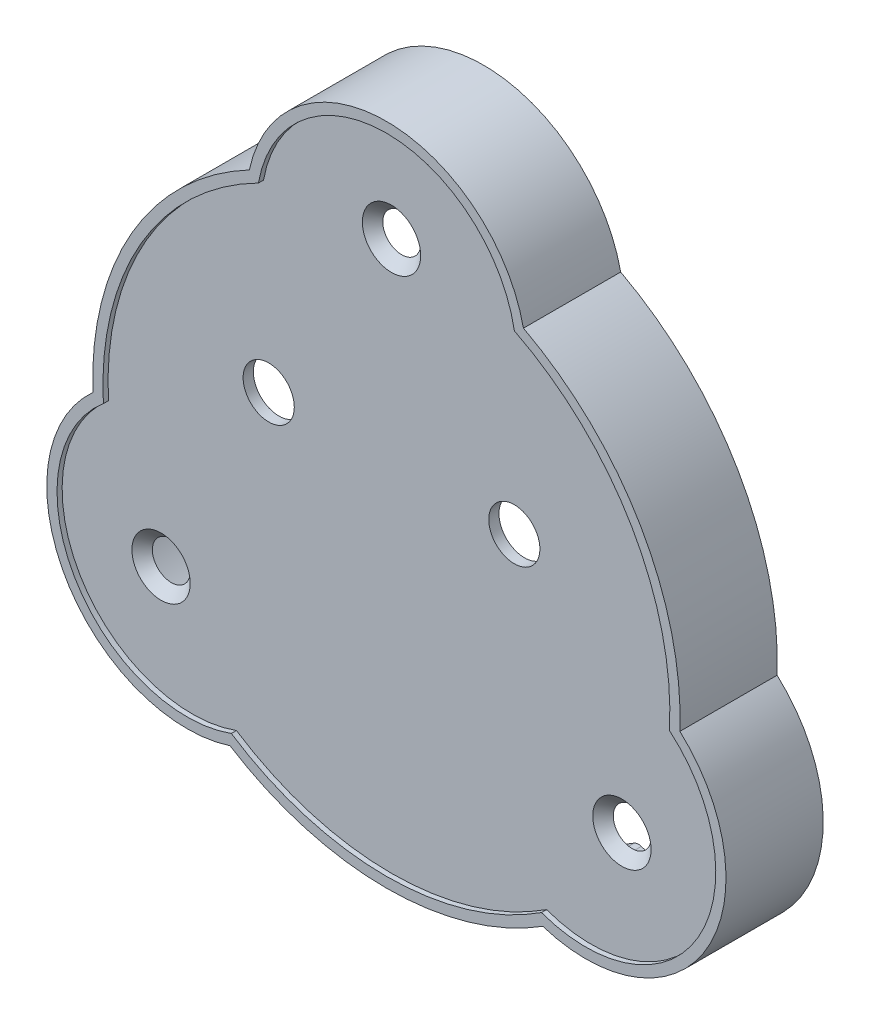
SolidWorks part; units mm, degrees
ref_plane "Спереди" through (0, 0, 0) normal (0, 0, 1) x (1, 0, 0)
ref_plane "Сверху" through (0, 0, 0) normal (0, 1, 0) x (1, 0, 0)
ref_plane "Справа" through (0, 0, 0) normal (1, 0, 0) x (0, 0, -1)
sketch "Эскиз1" plane through (0, 0, -4.0645) normal (0, 0, 1) x (1, 0, 0)
  arc A115 (5.7573, -12.2485) -> (6.0461, -11.585) centre (5.2474, -11.6321) ccw
  arc A116 (5.7573, -12.2485) -> (17.2937, -32.2301) centre (13.2142, -21.2643) ccw
  arc A117 (18.0127, -32.3118) -> (17.2937, -32.2301) centre (17.5726, -32.9799) ccw
  arc A118 (18.0127, -32.3118) -> (47.387, -32.3118) centre (32.6998, -10.0143) ccw
  arc A119 (48.106, -32.2301) -> (47.387, -32.3118) centre (47.827, -32.9799) ccw
  arc A120 (48.106, -32.2301) -> (59.6423, -12.2485) centre (52.1854, -21.2643) ccw
  arc A121 (59.3536, -11.585) -> (59.6423, -12.2485) centre (60.1522, -11.6321) ccw
  arc A122 (59.3536, -11.585) -> (44.6664, 13.8539) centre (32.6998, -10.0143) ccw
  arc A123 (44.2362, 14.4357) -> (44.6664, 13.8539) centre (45.025, 14.569) ccw
  arc A124 (44.2362, 14.4357) -> (21.1635, 14.4357) centre (32.6998, 12.4857) ccw
  arc A125 (20.7332, 13.8539) -> (21.1635, 14.4357) centre (20.3746, 14.569) ccw
  arc A126 (20.7332, 13.8539) -> (6.0461, -11.585) centre (32.6998, -10.0143) ccw
  arc A127 (5.7573, -12.2485) -> (6.0461, -11.585) centre (5.2474, -11.6321) ccw
  arc A128 (5.7573, -12.2485) -> (17.2937, -32.2301) centre (13.2142, -21.2643) ccw
  arc A129 (18.0127, -32.3118) -> (17.2937, -32.2301) centre (17.5726, -32.9799) ccw
  arc A130 (18.0127, -32.3118) -> (47.387, -32.3118) centre (32.6998, -10.0143) ccw
  arc A131 (48.106, -32.2301) -> (47.387, -32.3118) centre (47.827, -32.9799) ccw
  arc A132 (48.106, -32.2301) -> (59.6423, -12.2485) centre (52.1854, -21.2643) ccw
  arc A133 (59.3536, -11.585) -> (59.6423, -12.2485) centre (60.1522, -11.6321) ccw
  arc A134 (59.3536, -11.585) -> (44.6664, 13.8539) centre (32.6998, -10.0143) ccw
  arc A135 (44.2362, 14.4357) -> (44.6664, 13.8539) centre (45.025, 14.569) ccw
  arc A136 (44.2362, 14.4357) -> (21.1635, 14.4357) centre (32.6998, 12.4857) ccw
  arc A137 (20.7332, 13.8539) -> (21.1635, 14.4357) centre (20.3746, 14.569) ccw
  arc A138 (20.7332, 13.8539) -> (6.0461, -11.585) centre (32.6998, -10.0143) ccw
  dimension "D1" = 0.2
extrude "Вытянуть-Тонкостенный1" add sketch "Эскиз1" against normal blind 8 thin
sketch "Эскиз2" plane through (0, 0, -4.0645) normal (0, 0, 1) x (1, 0, 0)
  arc A5 (4.0206, -11.1072) -> (17.4138, -34.3048) centre (13.2142, -21.2643) ccw construction
  arc A6 (17.4138, -34.3048) -> (47.9858, -34.3048) centre (32.6998, -10.0143) ccw construction
  arc A7 (47.9858, -34.3048) -> (61.379, -11.1072) centre (52.1854, -21.2643) ccw construction
  arc A8 (61.379, -11.1072) -> (46.093, 15.369) centre (32.6998, -10.0143) ccw construction
  arc A9 (46.093, 15.369) -> (19.3067, 15.369) centre (32.6998, 12.4857) ccw construction
  arc A10 (19.3067, 15.369) -> (4.0206, -11.1072) centre (32.6998, -10.0143) ccw construction
  arc A11 (4.0206, -11.1072) -> (17.4138, -34.3048) centre (13.2142, -21.2643) ccw
  arc A12 (17.4138, -34.3048) -> (47.9858, -34.3048) centre (32.6998, -10.0143) ccw
  arc A13 (47.9858, -34.3048) -> (61.379, -11.1072) centre (52.1854, -21.2643) ccw
  arc A14 (61.379, -11.1072) -> (46.093, 15.369) centre (32.6998, -10.0143) ccw
  arc A15 (46.093, 15.369) -> (19.3067, 15.369) centre (32.6998, 12.4857) ccw
  arc A16 (19.3067, 15.369) -> (4.0206, -11.1072) centre (32.6998, -10.0143) ccw
  circle A19 centre (20.6998, -3.0143) radius 2.5 construction
  circle A20 centre (44.6998, -3.0143) radius 2.5 construction
  circle A24 centre (20.6998, -3.0143) radius 2.5
  circle A25 centre (44.6998, -3.0143) radius 2.5
  circle A27 centre (32.6998, 15.9857) radius 1.85
  circle A28 centre (55.2165, -23.0143) radius 1.85
  circle A29 centre (10.1832, -23.0143) radius 1.85
  dimension "D1" = 3.7
extrude "Бобышка-Вытянуть1" add sketch "Эскиз2" along normal blind 1
chamfer "Фаска1" distance 1 angle 45 3 edges at (12.0332, -23.0143, -3.0645) (57.0665, -23.0143, -3.0645) (34.5498, 15.9857, -3.0645)
sketch "Эскиз3" plane through (0, 0, -3.0645) normal (0, 0, 1) x (1, 0, 0)
  arc A0 (4.0206, -11.1072) -> (17.4138, -34.3048) centre (13.2142, -21.2643) ccw construction
  arc A1 (17.4138, -34.3048) -> (47.9858, -34.3048) centre (32.6998, -10.0143) ccw construction
  arc A2 (47.9858, -34.3048) -> (61.379, -11.1072) centre (52.1854, -21.2643) ccw construction
  arc A3 (61.379, -11.1072) -> (46.093, 15.369) centre (32.6998, -10.0143) ccw construction
  arc A4 (46.093, 15.369) -> (19.3067, 15.369) centre (32.6998, 12.4857) ccw construction
  arc A5 (19.3067, 15.369) -> (4.0206, -11.1072) centre (32.6998, -10.0143) ccw construction
  arc A6 (4.0206, -11.1072) -> (17.4138, -34.3048) centre (13.2142, -21.2643) ccw
  arc A7 (17.4138, -34.3048) -> (47.9858, -34.3048) centre (32.6998, -10.0143) ccw
  arc A8 (47.9858, -34.3048) -> (61.379, -11.1072) centre (52.1854, -21.2643) ccw
  arc A9 (61.379, -11.1072) -> (46.093, 15.369) centre (32.6998, -10.0143) ccw
  arc A10 (46.093, 15.369) -> (19.3067, 15.369) centre (32.6998, 12.4857) ccw
  arc A11 (19.3067, 15.369) -> (4.0206, -11.1072) centre (32.6998, -10.0143) ccw
  arc A12 (20.1948, 14.7024) -> (5.042, -11.543) centre (32.6998, -10.0143) ccw
  arc A13 (5.042, -11.543) -> (17.5471, -33.2023) centre (13.2142, -21.2643) ccw
  arc A14 (17.5471, -33.2023) -> (47.8525, -33.2023) centre (32.6998, -10.0143) ccw
  arc A15 (47.8525, -33.2023) -> (60.3576, -11.543) centre (52.1854, -21.2643) ccw
  arc A16 (60.3576, -11.543) -> (45.2049, 14.7024) centre (32.6998, -10.0143) ccw
  arc A17 (45.2049, 14.7024) -> (20.1948, 14.7024) centre (32.6998, 12.4857) ccw
  dimension "D1" = 1
extrude "Бобышка-Вытянуть2" add sketch "Эскиз3" along normal blind 0.5
ref_plane "Плоскость1" through (0, -38.7143, 0) normal (0, -1, 0) x (-1, 0, 0)
sketch "Эскиз4" plane through (0, -38.7143, 0) normal (0, -1, 0) x (-1, 0, 0)
  line L5 (-17.4138, 12.0645) -> (-47.9858, 12.0645) construction
  line L6 (-35.6998, 12.0645) -> (-29.6998, 12.0645)
  line L7 (-35.6998, 12.0645) -> (-35.6998, 8.4645)
  line L8 (-32.7998, 5.5645) -> (-32.5998, 5.5645)
  line L9 (-29.6998, 12.0645) -> (-29.6998, 8.4645)
  line L10 (-47.9858, 2.5645) -> (-17.4138, 2.5645) construction
  arc A0 (-35.6998, 8.4645) -> (-32.7998, 5.5645) centre (-32.7998, 8.4645) ccw
  arc A1 (-32.5998, 5.5645) -> (-29.6998, 8.4645) centre (-32.5998, 8.4645) ccw
  point P9 (-32.6998, 2.5645)
  point P10 (-32.6998, 5.5645)
  dimension "D3" = 2.9
  dimension "D1" = 6
  dimension "D2" = 3
extrude "Вырез-Вытянуть1" cut sketch "Эскиз4" against normal up to surface (2.1691 mm away)
